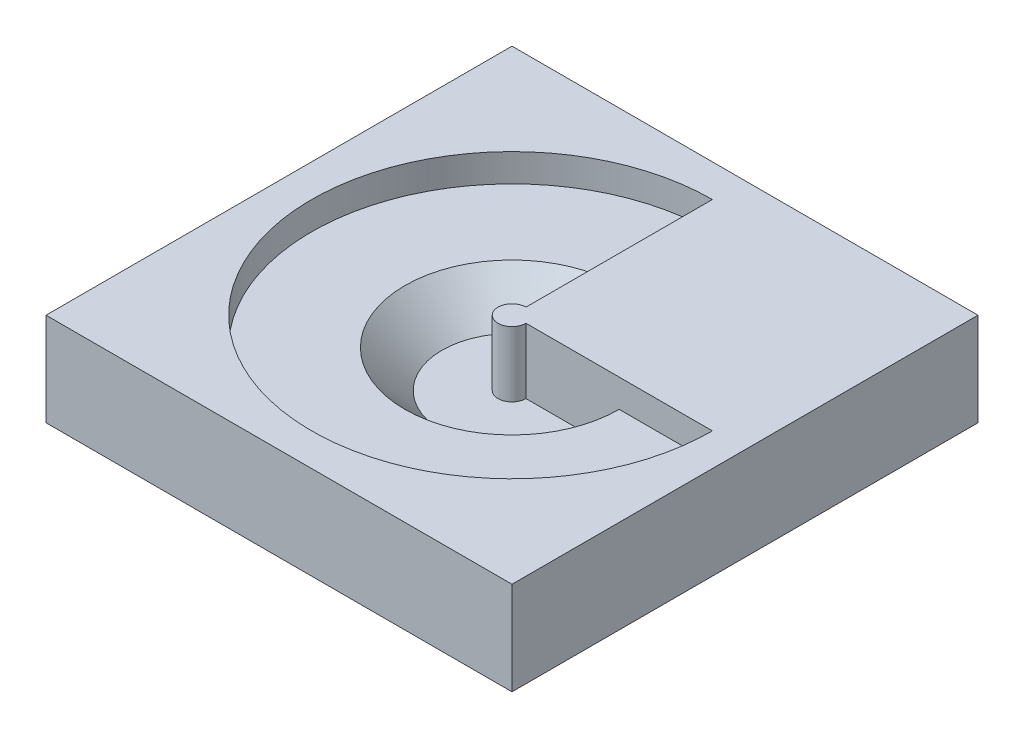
SolidWorks part; units mm, degrees
ref_plane "Front Plane" through (0, 0, 0) normal (0, 0, 1) x (1, 0, 0)
ref_plane "Top Plane" through (0, 0, 0) normal (0, 1, 0) x (1, 0, 0)
ref_plane "Right Plane" through (0, 0, 0) normal (1, 0, 0) x (0, 0, -1)
sketch "Sketch1" plane through (0, 0, 0) normal (0, 1, 0) x (1, 0, 0)
  line L0 (-50, 50) -> (50, -50) construction
  line L1 (-50, 50) -> (50, 50)
  line L2 (-50, 50) -> (-50, -50)
  line L3 (-50, -50) -> (50, -50)
  line L4 (50, 50) -> (50, -50)
  dimension "D1" = 100
  dimension "D2" = 100
extrude "Extrude1" add sketch "Sketch1" along normal mid plane 20
sketch "Sketch2" plane through (0, 0, 0) normal (0, 0, 1) x (1, 0, 0)
  line L0 (-3, 10) -> (-3, -4)
  line L1 (-50, 10) -> (50, 10) construction
  line L2 (-43, 4) -> (-23, 4)
  line L3 (-23, 4) -> (-15, -4)
  line L4 (-15, -4) -> (-3, -4)
  line L5 (0, 0) -> (0, 23.0783) construction
  line L6 (-3, 10) -> (-43, 10)
  line L7 (-50, -10) -> (50, -10) construction
  line L10 (-43, 10) -> (-43, 4)
  dimension "D1" = 6
  dimension "D2" = 135
  dimension "D3" = 12
  dimension "D4" = 40
  dimension "D5" = 6
  dimension "D6" = 3
  dimension "D7" = 20
revolve "Cut-Revolve1" cut sketch "Sketch2" angle 90 about L5
